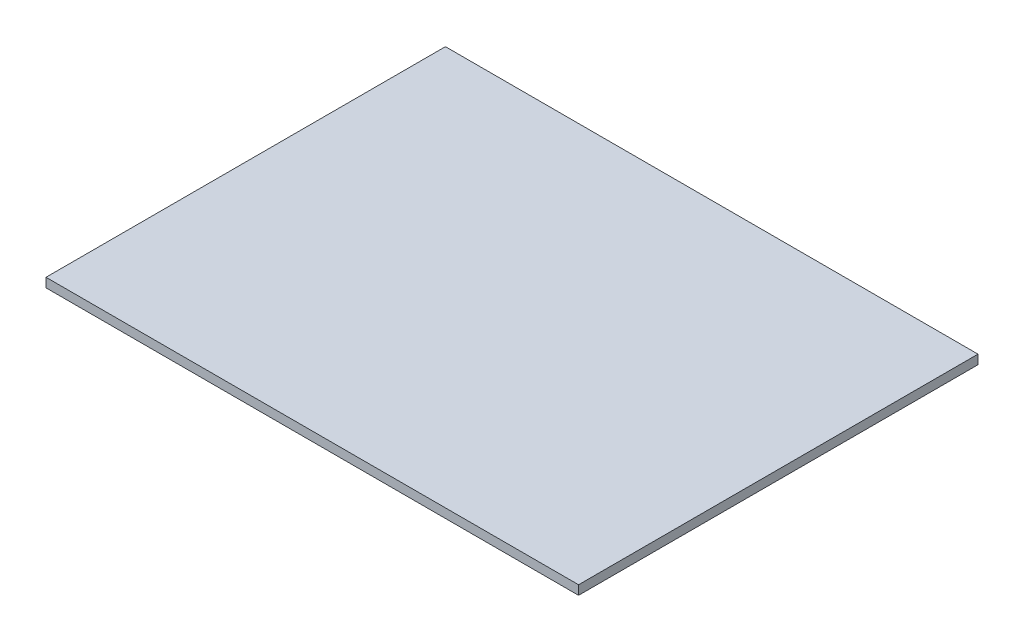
SolidWorks part; units mm, degrees
ref_plane "Plan de face" through (0, 0, 0) normal (0, 0, 1) x (1, 0, 0)
ref_plane "Plan de dessus" through (0, 0, 0) normal (0, 1, 0) x (1, 0, 0)
ref_plane "Plan de droite" through (0, 0, 0) normal (1, 0, 0) x (0, 0, -1)
sketch "Esquisse1" plane through (0, 0, 0) normal (0, 1, 0) x (1, 0, 0)
  line L1 (0, 0) -> (58, 0)
  line L2 (0, 0) -> (0, 43.5)
  line L3 (0, 43.5) -> (58, 43.5)
  line L4 (58, 0) -> (58, 43.5)
  dimension "D1" = 43.5
  dimension "D2" = 58
extrude "Boss.-Extru.1" add sketch "Esquisse1" along normal blind 1
